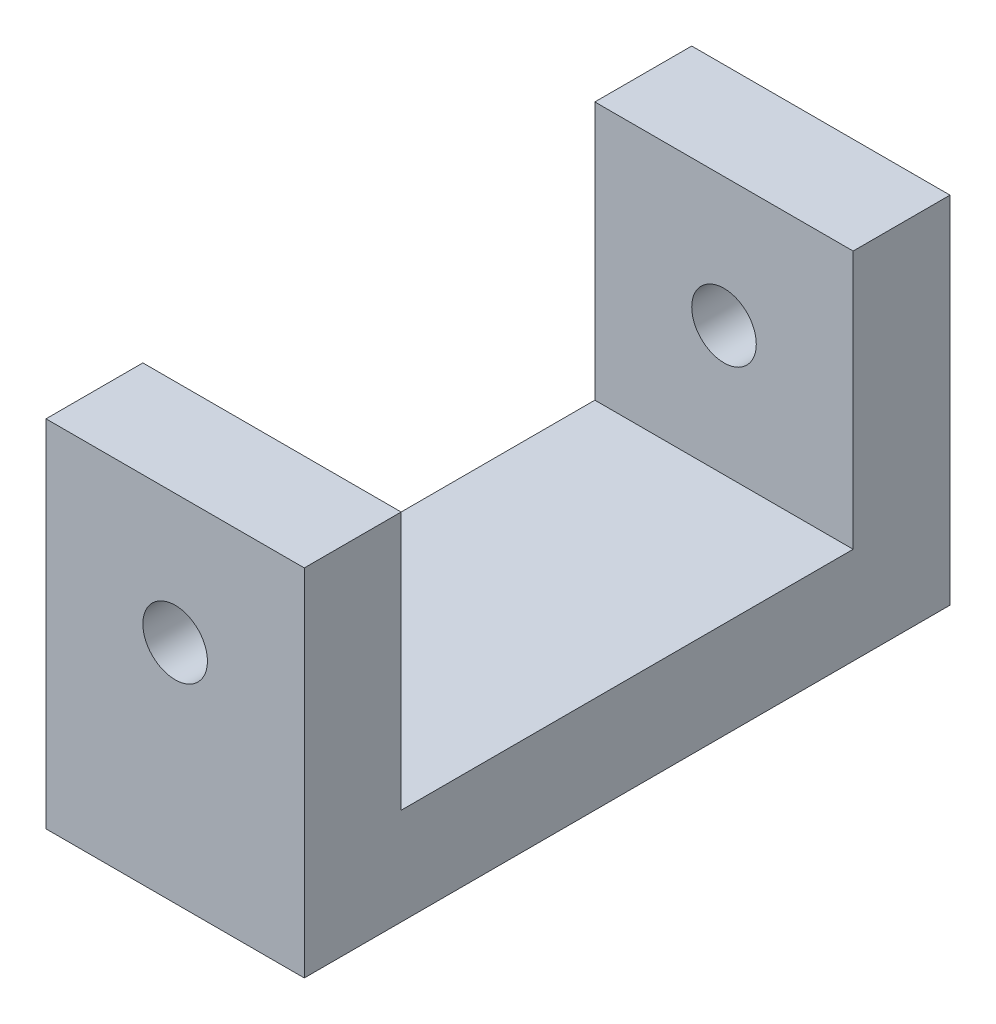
SolidWorks part; units mm, degrees
ref_plane "Front Plane" through (0, 0, 0) normal (0, 0, 1) x (1, 0, 0)
ref_plane "Top Plane" through (0, 0, 0) normal (0, 1, 0) x (1, 0, 0)
ref_plane "Right Plane" through (0, 0, 0) normal (1, 0, 0) x (0, 0, -1)
sketch "Sketch1" plane through (0, 0, 0) normal (0, 0, 1) x (1, 0, 0)
  line L1 (0, 0) -> (40, 0)
  line L2 (0, 0) -> (0, 45)
  line L3 (0, 45) -> (40, 45)
  line L4 (40, 0) -> (40, 45)
  dimension "D1" = 40
  dimension "D2" = 45
extrude "Boss-Extrude1" add sketch "Sketch1" against normal blind 100
sketch "Sketch2" plane through (40, 0, 0) normal (1, 0, 0) x (0, 0, -1)
  line L1 (100, 45) -> (0, 45) construction
  line L2 (15, 45) -> (15, 15)
  line L3 (15, 15) -> (85, 15)
  line L4 (85, 15) -> (85, 45)
  line L5 (85, 45) -> (15, 45)
  dimension "D2" = 30
  dimension "D3" = 70
extrude "Cut-Extrude1" cut sketch "Sketch2" against normal blind 40
sketch "Sketch5" plane through (40, 0, 0) normal (1, 0, 0) x (0, 0, -1)
  line L1 (15, 15) -> (85, 15)
  line L2 (15, 15) -> (15, 10)
  line L3 (15, 10) -> (85, 10)
  line L4 (85, 15) -> (85, 10)
  dimension "D1" = 70
  dimension "D2" = 5
extrude "Cut-Extrude4" cut sketch "Sketch5" against normal blind 40
sketch "Sketch6" plane through (0, 0, 0) normal (0, 0, 1) x (1, 0, 0)
  circle A0 centre (20, 35) radius 5
extrude "Cut-Extrude5" cut sketch "Sketch6" against normal blind 100
sketch "Sketch7" plane through (0, 45, 0) normal (0, 1, 0) x (1, 0, 0)
  line L1 (0, 0) -> (40, 0)
  line L2 (0, 0) -> (0, 15)
  line L3 (0, 15) -> (40, 15)
  line L4 (40, 0) -> (40, 15)
extrude "Boss-Extrude2" add sketch "Sketch7" along normal blind 10
sketch "Sketch8" plane through (0, 45, 0) normal (0, 1, 0) x (1, 0, 0)
  line L1 (0, 100) -> (40, 100)
  line L2 (0, 100) -> (0, 85)
  line L3 (0, 85) -> (40, 85)
  line L4 (40, 100) -> (40, 85)
extrude "Boss-Extrude3" add sketch "Sketch8" along normal blind 10
sketch "Sketch9" plane through (0, 10, 0) normal (0, 1, 0) x (1, 0, 0)
  line L1 (0, 85) -> (40, 85)
  line L2 (0, 85) -> (0, 15)
  line L3 (0, 15) -> (40, 15)
  line L4 (40, 85) -> (40, 15)
extrude "Boss-Extrude4" add sketch "Sketch9" along normal blind 5
